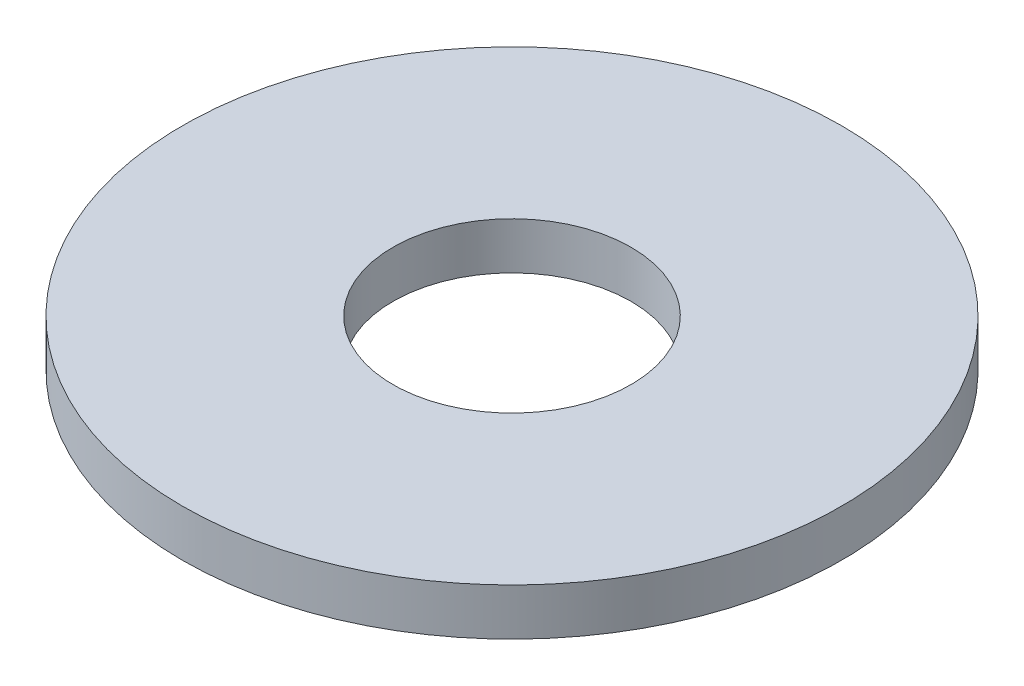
SolidWorks part; units mm, degrees
ref_plane "Front" through (0, 0, 0) normal (0, 0, 1) x (1, 0, 0)
ref_plane "Top" through (0, 0, 0) normal (0, 1, 0) x (1, 0, 0)
ref_plane "Right" through (0, 0, 0) normal (1, 0, 0) x (0, 0, -1)
sketch "Sketch1" plane through (0, 0, 0) normal (0, 0, 1) x (1, 0, 0)
  line L0 (0, -50.8) -> (0, 51.816) construction
  line L1 (2.5781, 0) -> (2.5781, 1.016)
  line L2 (2.5781, 1.016) -> (7.1374, 1.016)
  line L3 (7.1374, 1.016) -> (7.1374, 0)
  line L4 (7.1374, 0) -> (2.5781, 0)
revolve "Base-Revolve" add sketch "Sketch1" angle 360 about L0
